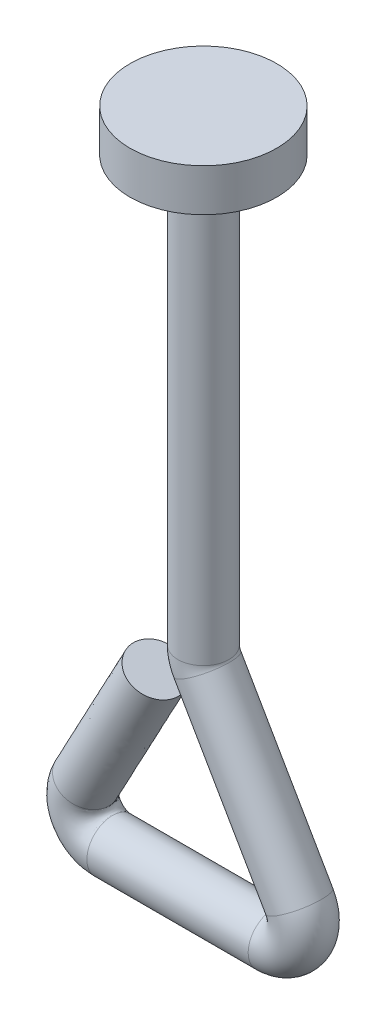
SolidWorks part; units mm, degrees
ref_plane "Plane1" through (0, 0, 0) normal (0, 0, 1) x (1, 0, 0)
ref_plane "Plane2" through (0, 0, 0) normal (0, 1, 0) x (1, 0, 0)
ref_plane "Plane3" through (0, 0, 0) normal (1, 0, 0) x (0, 0, -1)
sketch "Sketch1" plane through (-2.1154, -39.8184, 0) normal (0, 0, 1) x (1, 0, 0)
  line L0 (-3.4768, -15.4793) -> (-11.6717, -30.7591)
  line L1 (-8.609, -35.9533) -> (10.391, -35.9533)
  line L2 (13.4221, -30.7033) -> (2.5843, -11.9316)
  line L4 (2.1154, -10.1816) -> (2.1154, 39.8184)
  arc A0 (-8.609, -35.9533) -> (-11.6717, -30.7591) centre (-8.609, -32.4533) cw
  arc A1 (13.4221, -30.7033) -> (10.391, -35.9533) centre (10.391, -32.4533) cw
  arc A2 (2.5843, -11.9316) -> (2.1154, -10.1816) centre (5.6154, -10.1816) cw
  point P10 (-15, 0)
  point P13 (15, 0)
  dimension "D3" = 3.5
  dimension "D1" = 3.5
  dimension "D2" = 3.5
  dimension "D4" = 19
  dimension "D5" = 50
sketch "Sketch2" plane through (0, 0, 0) normal (0, 1, 0) x (1, 0, 0)
  circle A0 centre (0, 0) radius 3
  dimension "D1" = 6
sweep "Base-Sweep" add profiles "Sketch2" path "Sketch1"
sketch "Sketch3" plane through (0, 0, 0) normal (0, 1, 0) x (-1, 0, 0)
  circle A0 centre (0, 0) radius 8.6446
extrude "Boss-Extrude1" add sketch "Sketch3" along normal blind 4
sketch "Sketch4" plane through (0, 4, 0) normal (0, 1, 0) x (-1, 0, 0)
  circle A0 centre (0, 0) radius 8.6446
extrude "Boss-Extrude2" add sketch "Sketch4" along normal blind 1
